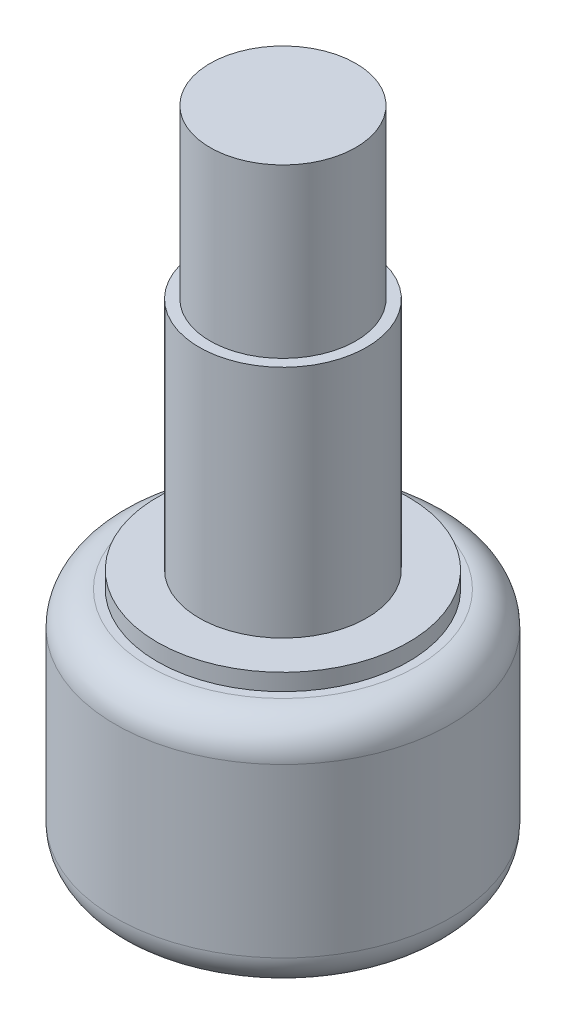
SolidWorks part; units mm, degrees
ref_plane "FRONT" through (0, 0, 0) normal (0, 0, 1) x (1, 0, 0)
ref_plane "TOP" through (0, 0, 0) normal (0, 1, 0) x (1, 0, 0)
ref_plane "RIGHT" through (0, 0, 0) normal (1, 0, 0) x (0, 0, -1)
sketch "Sketch1" plane through (0, 0, 0) normal (0, 0, 1) x (1, 0, 0)
  line L0 (0, 0) -> (0, 61.7457) construction
  line L1 (0, 0) -> (-6.35, 0)
  line L2 (-7.9375, 1.5875) -> (-7.9375, 9.525)
  line L3 (-6.35, 11.1125) -> (-5.9531, 11.1125)
  line L4 (-5.9531, 11.1125) -> (-5.9531, 11.9062)
  line L5 (-5.9531, 11.9062) -> (-3.9688, 11.9062)
  line L6 (-3.9688, 11.9062) -> (-3.9688, 23.0188)
  line L7 (-3.4544, 30.9563) -> (0, 30.9563)
  line L8 (0, 30.9563) -> (0, 0)
  line L9 (-3.9688, 23.0188) -> (-3.4544, 23.0188)
  line L10 (-3.4544, 23.0188) -> (-3.4544, 30.9563)
  arc A0 (-6.35, 11.1125) -> (-7.9375, 9.525) centre (-6.35, 9.525) ccw
  arc A1 (-7.9375, 1.5875) -> (-6.35, 0) centre (-6.35, 1.5875) ccw
  dimension "D1" = 1.5875
  dimension "ROLLER WIDTH" = 11.1125
  dimension "FOLLOWER DIA" = 15.875
  dimension "D4" = 0.7937
  dimension "STUD DIA" = 7.9375
  dimension "MIN BOSS DIA" = 11.9062
  dimension "STUD LENGTH" = 19.05
  dimension "MIN PERFECT THREAD" = 7.9375
  dimension "MIN THREAD DIA" = 6.9088
revolve "Base-Revolve" add sketch "Sketch1" angle 360 about L0
